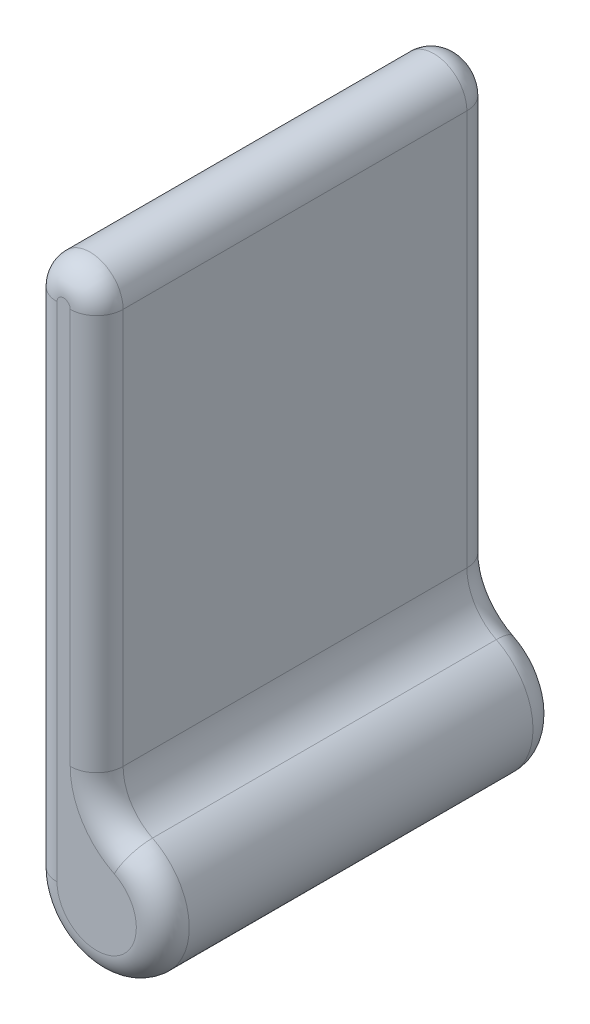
SolidWorks part; units mm, degrees
ref_plane "Front Plane" through (0, 0, 0) normal (0, 0, 1) x (1, 0, 0)
ref_plane "Top Plane" through (0, 0, 0) normal (0, 1, 0) x (1, 0, 0)
ref_plane "Right Plane" through (0, 0, 0) normal (1, 0, 0) x (0, 0, -1)
sketch "Sketch1" plane through (0, 0, 0) normal (0, 0, 1) x (1, 0, 0)
  line L2 (-0.3175, 0) -> (-0.3175, -4.826)
  line L4 (0.3175, 0) -> (0.3175, -3.8021)
  arc A0 (0.3175, 0) -> (-0.3175, 0) centre (0, 0) ccw
  arc A1 (-0.3175, -4.826) -> (0.5997, -4.2572) centre (0.3175, -4.826) ccw
  arc A2 (0.5997, -4.2572) -> (0.3175, -3.8021) centre (0.8255, -3.8021) cw
  dimension "D1" = 0.508
  dimension "D2" = 4.826
  dimension "D3" = 0.635
extrude "Boss-Extrude1" add sketch "Sketch1" along normal blind 3.81
fillet "Fillet1" radius 0.254 10 edges at (0.3938, -4.0698, 3.81) (0.6522, -5.3656, 3.81) (-0.3175, -2.413, 3.81) (0, 0.3175, 3.81) (-0.3175, -2.413, 0) (0, 0.3175, 0) (0.3175, -1.901, 0) (0.3938, -4.0698, 0) (0.3175, -1.901, 3.81) (0.6522, -5.3656, 0)
